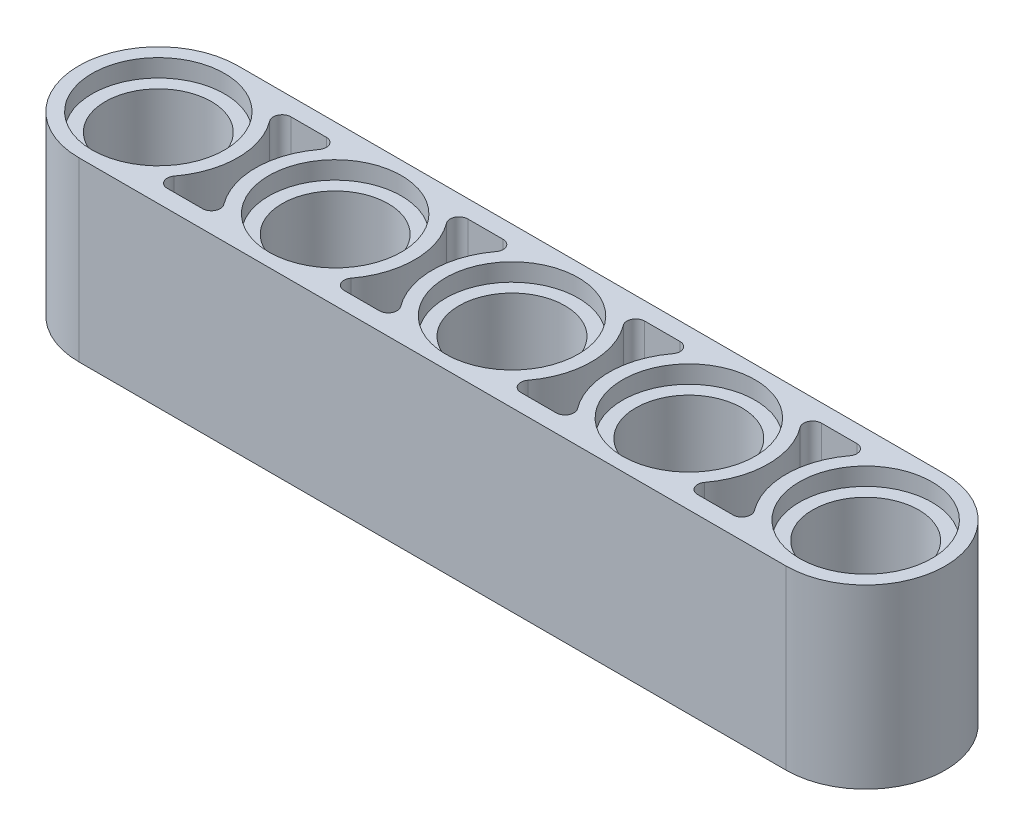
SolidWorks part; units mm, degrees
ref_plane "Front Plane" through (0, 0, 0) normal (0, 0, 1) x (1, 0, 0)
ref_plane "Top Plane" through (0, 0, 0) normal (0, 1, 0) x (1, 0, 0)
ref_plane "Right Plane" through (0, 0, 0) normal (1, 0, 0) x (0, 0, -1)
sketch "Sketch1" plane through (0, 0, 0) normal (0, 1, 0) x (1, 0, 0)
  line L6 (0, 3.6) -> (32, 3.6)
  line L7 (32, -3.6) -> (0, -3.6)
  circle A0 centre (0, 0) radius 2.4
  circle A1 centre (8, 0) radius 2.4
  circle A2 centre (16, 0) radius 2.4
  circle A3 centre (24, 0) radius 2.4
  circle A9 centre (32, 0) radius 2.4
  arc A14 (0, 3.6) -> (0, -3.6) centre (0, 0) ccw
  arc A15 (32, -3.6) -> (32, 3.6) centre (32, 0) ccw
  dimension "D1" = 4.8
  dimension "D4" = 3.6
  dimension "D5" = 8
  dimension "D3" = 3.6
  dimension "D2" = 5
extrude "Boss-Extrude1" add sketch "Sketch1" along normal blind 8
sketch "Sketch6" plane through (0, 8, 0) normal (0, 1, 0) x (1, 0, 0)
  line L0 (0, 0) -> (8, 0) construction
  circle A0 centre (0, 0) radius 3
  circle A1 centre (8, 0) radius 3
  circle A2 centre (16, 0) radius 3
  circle A3 centre (24, 0) radius 3
  circle A4 centre (32, 0) radius 3
  dimension "D1" = 6
  dimension "D2" = 8
extrude "Cut-Extrude4" cut sketch "Sketch6" against normal blind 0.8
sketch "Sketch7" plane through (0, 8, 0) normal (0, 1, 0) x (1, 0, 0)
  line L0 (3.2, 2.8) -> (4.8, 2.8)
  line L1 (4.8, -2.8) -> (3.2, -2.8)
  line L2 (32, 3.6) -> (0, 3.6) construction
  line L3 (0, -3.6) -> (32, -3.6) construction
  line L4 (11.2, 2.8) -> (12.8, 2.8)
  line L5 (12.8, -2.8) -> (11.2, -2.8)
  line L6 (19.2, 2.8) -> (20.8, 2.8)
  line L7 (20.8, -2.8) -> (19.2, -2.8)
  line L8 (27.2, 2.8) -> (28.8, 2.8)
  line L9 (28.8, -2.8) -> (27.2, -2.8)
  line L10 (3.2, 2.8) -> (11.2, 2.8) construction
  arc A0 (2.88, -2.16) -> (2.88, 2.16) centre (0, 0) ccw
  arc A1 (5.12, 2.16) -> (5.12, -2.16) centre (8, 0) ccw
  arc A2 (3.2, -2.8) -> (2.88, -2.16) centre (3.2, -2.4) cw
  arc A3 (4.8, -2.8) -> (5.12, -2.16) centre (4.8, -2.4) ccw
  arc A4 (4.8, 2.8) -> (5.12, 2.16) centre (4.8, 2.4) cw
  arc A5 (3.2, 2.8) -> (2.88, 2.16) centre (3.2, 2.4) ccw
  arc A6 (10.88, -2.16) -> (10.88, 2.16) centre (8, 0) ccw
  arc A7 (13.12, 2.16) -> (13.12, -2.16) centre (16, 0) ccw
  arc A8 (11.2, -2.8) -> (10.88, -2.16) centre (11.2, -2.4) cw
  arc A9 (12.8, -2.8) -> (13.12, -2.16) centre (12.8, -2.4) ccw
  arc A10 (12.8, 2.8) -> (13.12, 2.16) centre (12.8, 2.4) cw
  arc A11 (11.2, 2.8) -> (10.88, 2.16) centre (11.2, 2.4) ccw
  arc A12 (18.88, -2.16) -> (18.88, 2.16) centre (16, 0) ccw
  arc A13 (21.12, 2.16) -> (21.12, -2.16) centre (24, 0) ccw
  arc A14 (19.2, -2.8) -> (18.88, -2.16) centre (19.2, -2.4) cw
  arc A15 (20.8, -2.8) -> (21.12, -2.16) centre (20.8, -2.4) ccw
  arc A16 (20.8, 2.8) -> (21.12, 2.16) centre (20.8, 2.4) cw
  arc A17 (19.2, 2.8) -> (18.88, 2.16) centre (19.2, 2.4) ccw
  arc A18 (26.88, -2.16) -> (26.88, 2.16) centre (24, 0) ccw
  arc A19 (29.12, 2.16) -> (29.12, -2.16) centre (32, 0) ccw
  arc A20 (27.2, -2.8) -> (26.88, -2.16) centre (27.2, -2.4) cw
  arc A21 (28.8, -2.8) -> (29.12, -2.16) centre (28.8, -2.4) ccw
  arc A22 (28.8, 2.8) -> (29.12, 2.16) centre (28.8, 2.4) cw
  arc A23 (27.2, 2.8) -> (26.88, 2.16) centre (27.2, 2.4) ccw
  dimension "D3" = 0.4
  dimension "D1" = 0.8
  dimension "D2" = 0.8
  dimension "D4" = 8
extrude "Cut-Extrude5" cut sketch "Sketch7" against normal blind 3.2
ref_plane "Plane3" through (0, 4, 0) normal (0, 1, 0) x (1, 0, 0)
mirror "Mirror2" about plane through (0, 4, 0) normal (0, 1, 0) of "Cut-Extrude5", "Cut-Extrude4"
